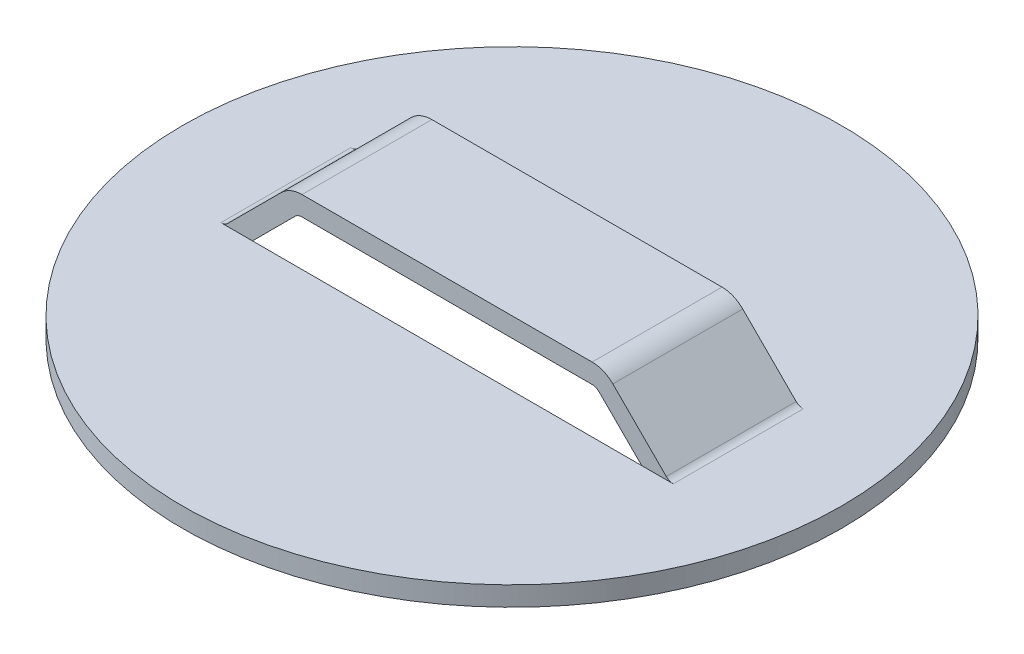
SolidWorks part; units mm, degrees
other "Boss-Extrude1"
ref_plane "Front Plane" through (0, 0, 0) normal (0, 0, 1) x (1, 0, 0)
ref_plane "Top Plane" through (0, 0, 0) normal (0, 1, 0) x (1, 0, 0)
ref_plane "Right Plane" through (0, 0, 0) normal (1, 0, 0) x (0, 0, -1)
imported_body "Imported1"
sketch "Sketch1" plane through (0, -1.4986, 0) normal (0, -1, 0) x (1, 0, 0)
  line L0 (0, 0) -> (0, -10.0076) construction
  line L1 (11.1794, -10.0076) -> (-11.1794, -10.0076) construction
  line L2 (25.4, -10.0076) -> (25.4, 0) construction
  line L3 (-17.4352, -10.0076) -> (17.4352, -10.0076)
  line L4 (-17.4352, -10.0076) -> (-17.4352, 0)
  line L5 (-17.4352, 0) -> (17.4352, 0)
  line L6 (17.4352, -10.0076) -> (17.4352, 0)
  line L7 (-17.4352, -10.0076) -> (17.4352, 0) construction
  line L8 (-17.4352, 0) -> (17.4352, -10.0076) construction
  circle A0 centre (0, -5.0038) radius 25.4
  point P5 (0, -5.0038)
extrude "Boss-Extrude1" add sketch "Sketch1" against normal up to vertex
other "DeleteFace1"
